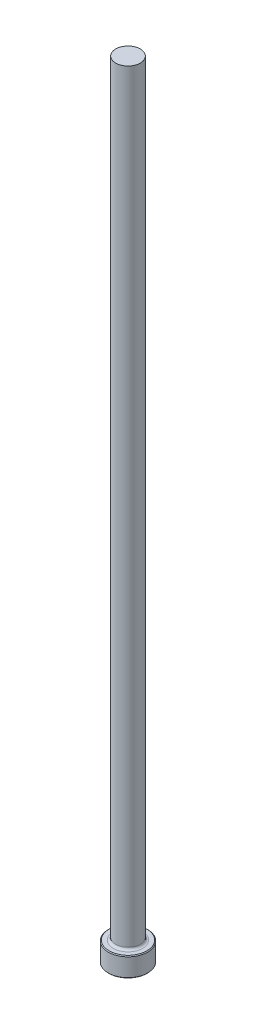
SolidWorks part; units mm, degrees
ref_plane "Front Plane" through (0, 0, 0) normal (0, 0, 1) x (1, 0, 0)
ref_plane "Top Plane" through (0, 0, 0) normal (0, 1, 0) x (1, 0, 0)
ref_plane "Right Plane" through (0, 0, 0) normal (1, 0, 0) x (0, 0, -1)
sketch "Sketch1" plane through (0, 0, 0) normal (0, 0, 1) x (1, 0, 0)
  line L0 (0, 259.9588) -> (0, -15.1925) construction
  line L1 (0, 0) -> (-6.35, 0)
  line L2 (-6.35, 0) -> (-6.35, 6.35)
  line L3 (-6.35, 6.35) -> (-3.9687, 6.35)
  line L4 (-3.9687, 6.35) -> (-3.9687, 254)
  line L5 (-3.9687, 254) -> (0, 254)
  line L6 (0, 254) -> (0, 0)
  dimension "L" = 254
  dimension "H" = 12.7
  dimension "T" = 6.35
  dimension "D" = 7.9375
revolve "Revolve1" add sketch "Sketch1" angle 360 about L0
chamfer "Chamfer1" distance 0.254 angle 45 2 edges at (0, 6.35, 6.35) (0, 0, 6.35)
fillet "Fillet1" radius 0.762 1 edges at (0, 6.35, 3.9687)
sketch "Pocket Sketch" plane through (0, 0, 0) normal (0, 0, 1) x (1, 0, 0)
  line L0 (-6.7469, 0) -> (-6.7469, 6.3754)
  line L1 (-6.7469, 6.3754) -> (-5.1276, 6.3754)
  line L2 (-4.3656, 7.1374) -> (-4.3656, 22.225)
  line L3 (-4.3656, 22.225) -> (0, 22.225)
  line L4 (0, 22.225) -> (0, 0)
  line L5 (0, 0) -> (-6.7469, 0)
  line L6 (0, 12.6104) -> (0, -2.4989) construction
  line L7 (-6.35, 6.096) -> (-6.35, 0.254) construction
  line L8 (6.096, 6.35) -> (-6.096, 6.35) construction
  line L9 (-3.9687, 254) -> (-3.9687, 7.112) construction
  line L10 (-5.1276, 6.3754) -> (-4.3656, 7.1374)
  point P3 (-4.3656, 6.3754)
  dimension "D1" = 13.4937
  dimension "D2" = 0.3969
  dimension "D3" = 0.0254
  dimension "D4" = 0.3969
  dimension "D5" = 8.7312
  dimension "D6" = 22.225
